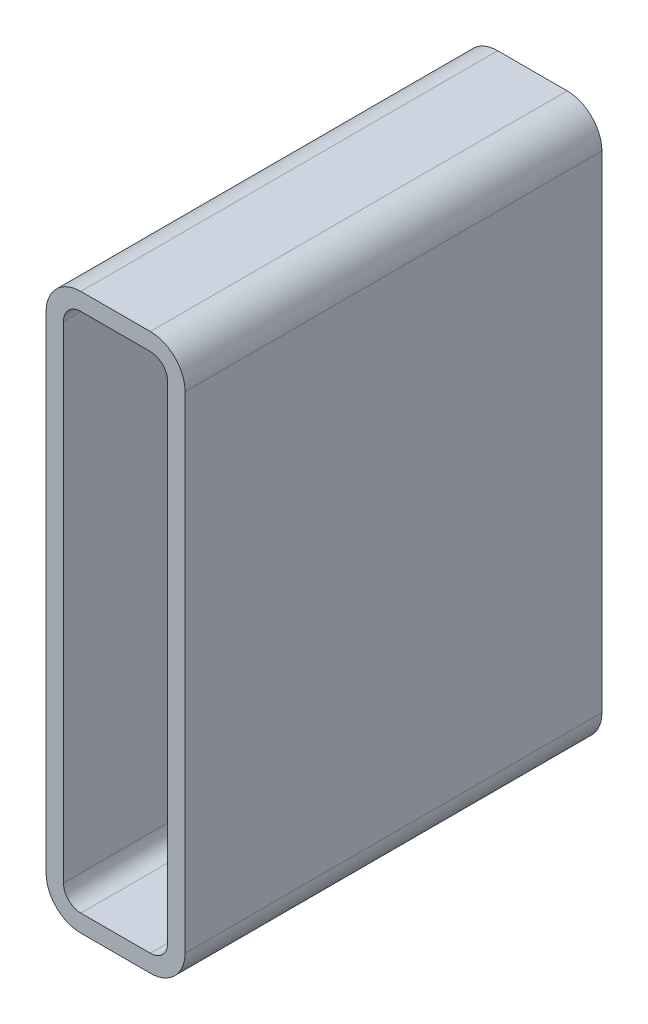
SolidWorks part; units mm, degrees
ref_plane "Front Plane" through (0, 0, 0) normal (0, 0, 1) x (1, 0, 0)
ref_plane "Top Plane" through (0, 0, 0) normal (0, 1, 0) x (1, 0, 0)
ref_plane "Right Plane" through (0, 0, 0) normal (1, 0, 0) x (0, 0, -1)
sketch "Sketch1" plane through (0, 0, 0) normal (0, 0, 1) x (1, 0, 0)
  point P0 (0, 0)
sketch_block_instance "HSS16x4x0.500-1"
sketch_block "HSS16x4x0.500"
extrude "Boss-Extrude1" add sketch "Sketch1" along normal blind 304.8
